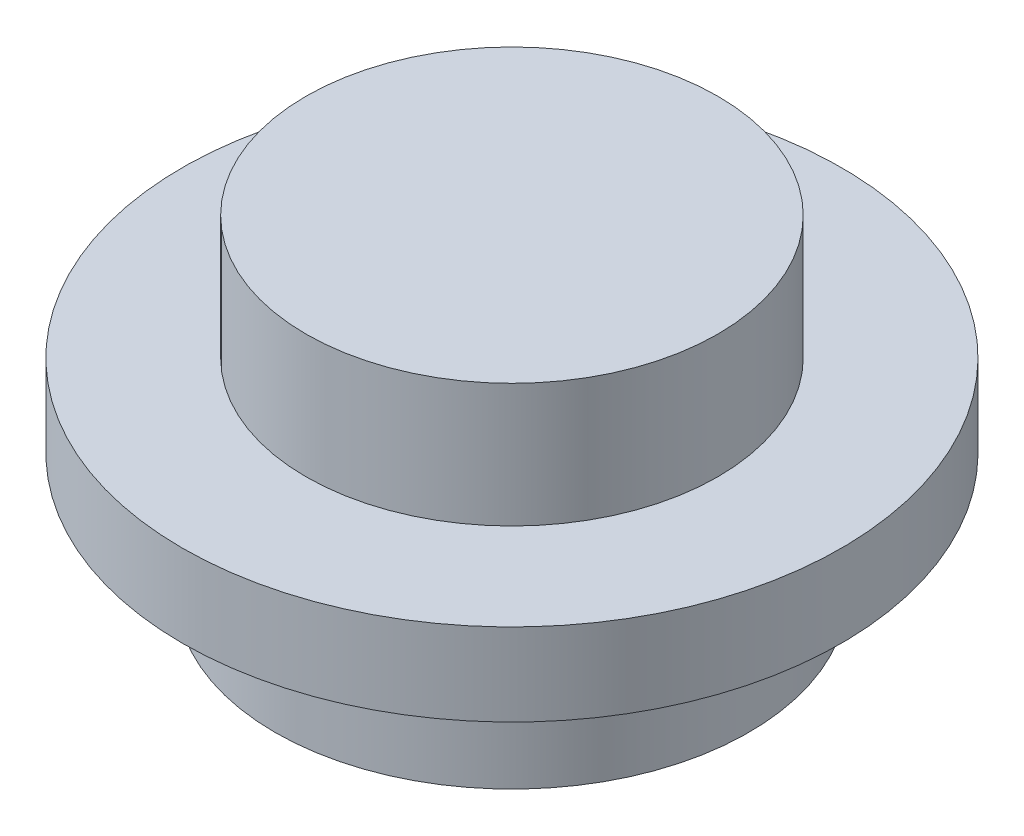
SolidWorks part; units mm, degrees
ref_plane "Face" through (0, 0, 0) normal (0, 0, 1) x (1, 0, 0)
ref_plane "Dessus" through (0, 0, 0) normal (0, 1, 0) x (1, 0, 0)
ref_plane "Droite" through (0, 0, 0) normal (1, 0, 0) x (0, 0, -1)
sketch "Esquisse1" plane through (0, 0, 0) normal (0, 1, 0) x (1, 0, 0)
  circle A0 centre (0, 0) radius 2.5
  circle A1 centre (0, 0) radius 2.875
  dimension "D1" = 5
  dimension "D2" = 5.75
extrude "Extrusion1" add sketch "Esquisse1" along normal blind 1.5
sketch "Esquisse2" plane through (0, 1.5, 0) normal (0, 1, 0) x (-1, 0, 0)
  circle A0 centre (0, 0) radius 4
  dimension "D1" = 8
extrude "Extrusion2" add sketch "Esquisse2" along normal blind 1
sketch "Esquisse3" plane through (0, 2.5, 0) normal (0, 1, 0) x (-1, 0, 0)
  circle A0 centre (0, 0) radius 2.5
  dimension "D1" = 5
extrude "Extrusion3" add sketch "Esquisse3" along normal blind 1.5
